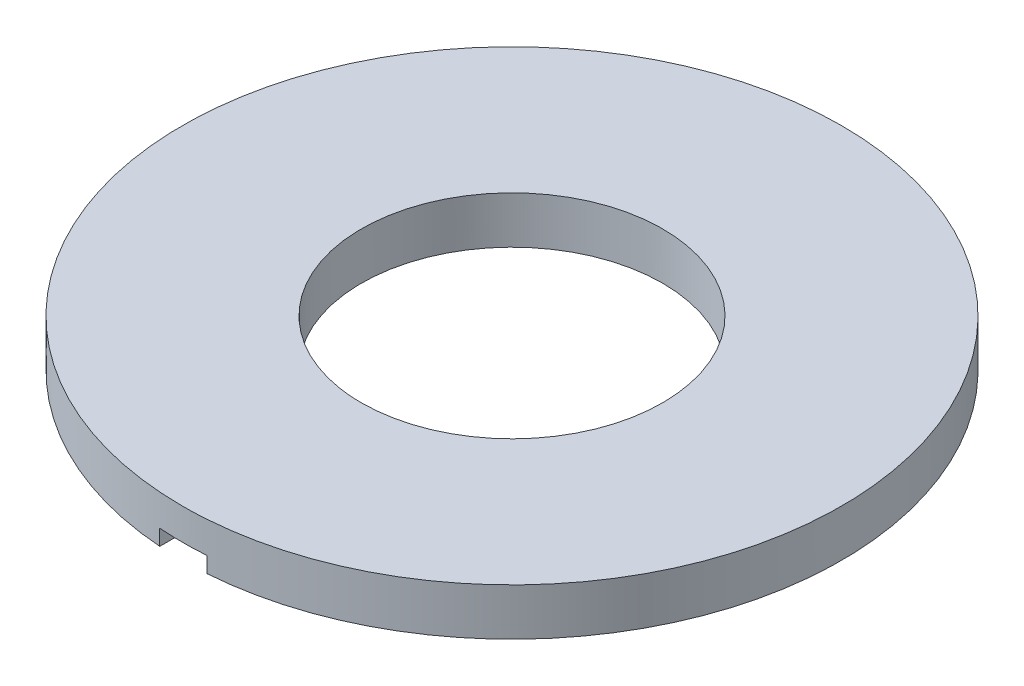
SolidWorks part; units mm, degrees
ref_plane "Front Plane" through (0, 0, 0) normal (0, 0, 1) x (1, 0, 0)
ref_plane "Top Plane" through (0, 0, 0) normal (0, 1, 0) x (1, 0, 0)
ref_plane "Right Plane" through (0, 0, 0) normal (1, 0, 0) x (0, 0, -1)
sketch "Sketch1" plane through (0, 0, 0) normal (0, 1, 0) x (1, 0, 0)
  circle A0 centre (0, 0) radius 1.6
  circle A1 centre (0, 0) radius 3.5
  dimension "D1" = 3.2
  dimension "D2" = 7
extrude "Extrude1" add sketch "Sketch1" along normal blind 0.5
sketch "Sketch2" plane through (0, 0, 0) normal (0, -1, 0) x (1, 0, 0)
  line L1 (-0.25, -0.3) -> (0.25, -0.3)
  line L2 (-0.25, -0.3) -> (-0.25, 3.5)
  line L3 (-0.25, 3.5) -> (0.25, 3.5)
  line L4 (0.25, -0.3) -> (0.25, 3.5)
  line L5 (-0.25, -0.3) -> (0.25, 3.5) construction
  line L6 (-0.25, 3.5) -> (0.25, -0.3) construction
  circle A0 centre (0, 0) radius 1.6 construction
  circle A1 centre (0, 0) radius 3.5 construction
  point P0 (0, 1.6)
  dimension "D1" = 0.5
extrude "Cut-Extrude1" cut sketch "Sketch2" against normal blind 0.1667
